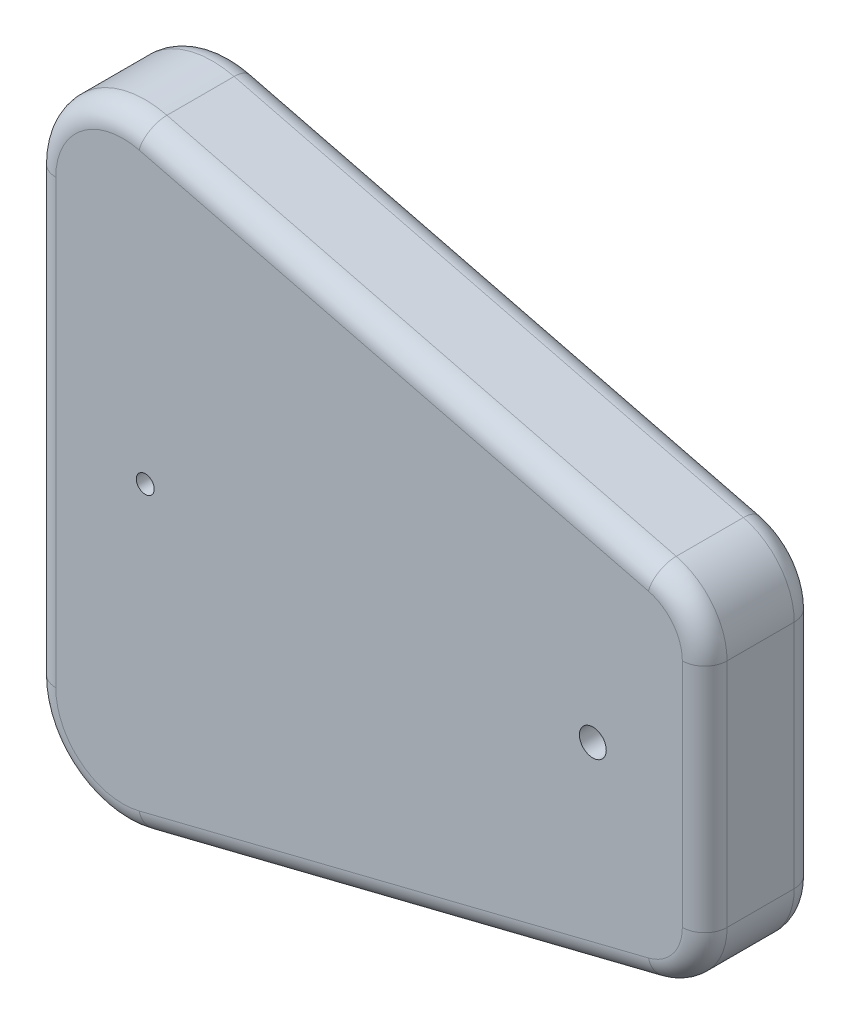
SolidWorks part; units mm, degrees
ref_plane "Plan de face" through (0, 0, 0) normal (0, 0, 1) x (1, 0, 0)
ref_plane "Plan de dessus" through (0, 0, 0) normal (0, 1, 0) x (1, 0, 0)
ref_plane "Plan de droite" through (0, 0, 0) normal (1, 0, 0) x (0, 0, -1)
sketch "Esquisse1" plane through (0, 0, 0) normal (0, 0, 1) x (1, 0, 0)
  line L0 (-59.9222, 0) -> (346.4204, 0) construction
  line L1 (49.7014, -137.5746) -> (277.2761, -80.681)
  line L2 (0, -98.7689) -> (0, 98.7689)
  line L3 (49.7014, 137.5746) -> (277.2761, 80.681)
  line L4 (300, 51.5767) -> (300, -51.5767)
  arc A0 (0, 98.7689) -> (49.7014, 137.5746) centre (40, 98.7689) cw
  arc A1 (277.2761, 80.681) -> (300, 51.5767) centre (270, 51.5767) cw
  arc A2 (277.2761, -80.681) -> (300, -51.5767) centre (270, -51.5767) ccw
  arc A3 (0, -98.7689) -> (49.7014, -137.5746) centre (40, -98.7689) ccw
  point P8 (0, 150)
  point P12 (300, 75)
  point P14 (300, 0)
  point P19 (0, 0)
  dimension "D4" = 40
  dimension "D5" = 30
  dimension "D1" = 150
  dimension "D2" = 300
  dimension "D3" = 75
extrude "Boss.-Extru.1" add sketch "Esquisse1" along normal blind 50
fillet "Congé1" radius 10 16 edges at (163.4887, 109.1278, 50) (293.6462, 70.0391, 50) (300, 0, 50) (293.6462, -70.0391, 50) (163.4887, -109.1278, 50) (15.3835, -130.2972, 50) (0, 0, 50) (15.3835, 130.2972, 50) (0, 0, 0) (15.3835, -130.2972, 0) (163.4887, -109.1278, 0) (293.6462, -70.0391, 0) (300, 0, 0) (293.6462, 70.0391, 0) (163.4887, 109.1278, 0) (15.3835, 130.2972, 0)
sketch "Esquisse2" plane through (0, 0, 50) normal (0, 0, 1) x (1, 0, 0)
  line L0 (335.324, 0) -> (-53.0076, 0) construction
  line L1 (0, -98.7689) -> (0, 98.7689) construction
  circle A0 centre (50, 0) radius 4
  circle A1 centre (250, 0) radius 6
  dimension "D1" = 8
  dimension "D2" = 12
  dimension "D3" = 50
  dimension "D4" = 200
extrude "Enlèv. mat.-Extru.1" cut sketch "Esquisse2" against normal blind 30
